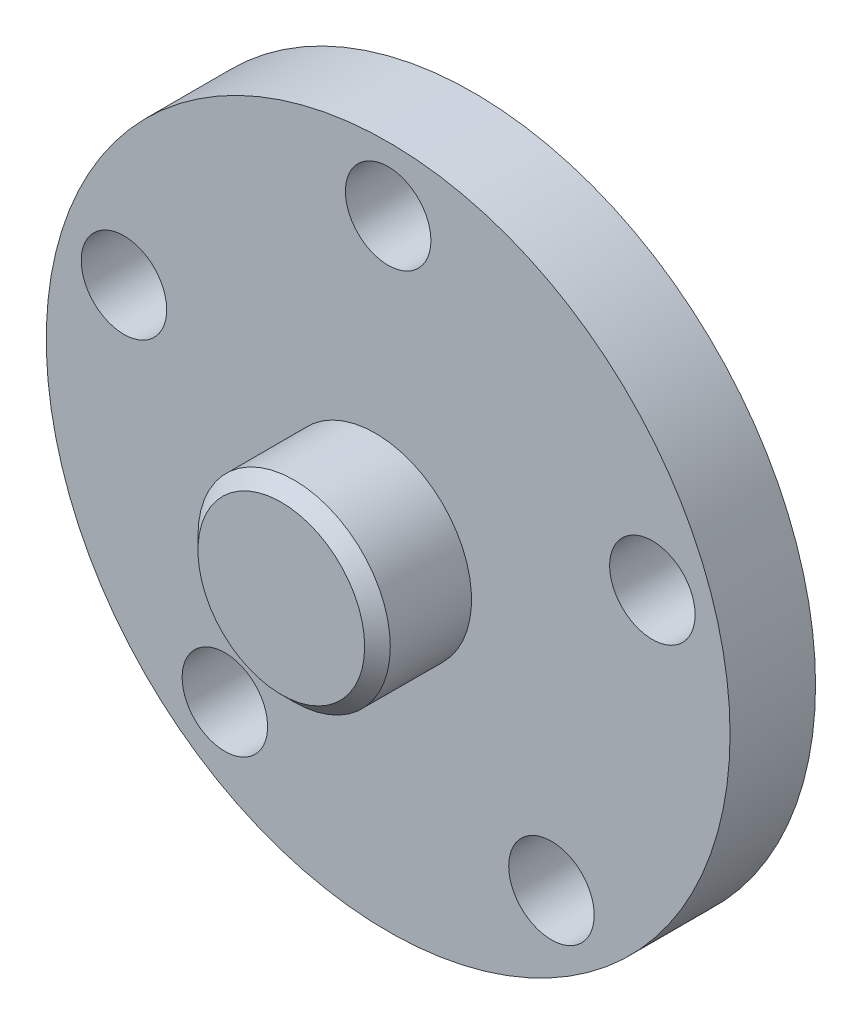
SolidWorks part; units mm, degrees
ref_plane "Front" through (0, 0, 0) normal (0, 0, 1) x (1, 0, 0)
ref_plane "Top" through (0, 0, 0) normal (0, 1, 0) x (1, 0, 0)
ref_plane "Right" through (0, 0, 0) normal (1, 0, 0) x (0, 0, -1)
sketch "Sketch1" plane through (0, 0, 0) normal (0, 0, 1) x (1, 0, 0)
  circle A0 centre (0, 0) radius 80
  dimension "D1" = 160
extrude "Base-Extrude" add sketch "Sketch1" along normal blind 20
sketch "Sketch2" plane through (0, 0, 0) normal (0, 1, 0) x (1, 0, 0)
  line L0 (0, 0) -> (0, -61.8831) construction
  line L1 (0, -20) -> (0, 0) construction
  line L2 (-10, -20) -> (-10, -23)
  line L3 (-80, -20) -> (80, -20) construction
  line L4 (-10, -23) -> (-22.5, -23)
  line L5 (-22.5, -23) -> (-22.5, -45)
  line L6 (-22.5, -45) -> (0, -45)
  line L7 (0, -45) -> (0, -20)
  line L8 (0, -20) -> (-10, -20)
  dimension "D1" = 45
  dimension "D2" = 25
  dimension "D3" = 20
  dimension "D4" = 22
revolve "Boss-Revolve1" add sketch "Sketch2" angle 360 about L0
chamfer "Chamfer1" distance 3 angle 45 1 edges at (-22.5, 0, 45)
sketch "Sketch3" plane through (0, 0, 20) normal (0, 0, 1) x (1, 0, 0)
  circle A0 centre (0, 65) radius 10
  circle A1 centre (0, 0) radius 65 construction
  dimension "D1" = 130
  dimension "D2" = 20
extrude "Cut-Extrude1" cut sketch "Sketch3" against normal through all
pattern_circular "CirPattern1" count 5 over 360 about axis through (0, 0, 0) along (0, 0, 1) of "Cut-Extrude1"
